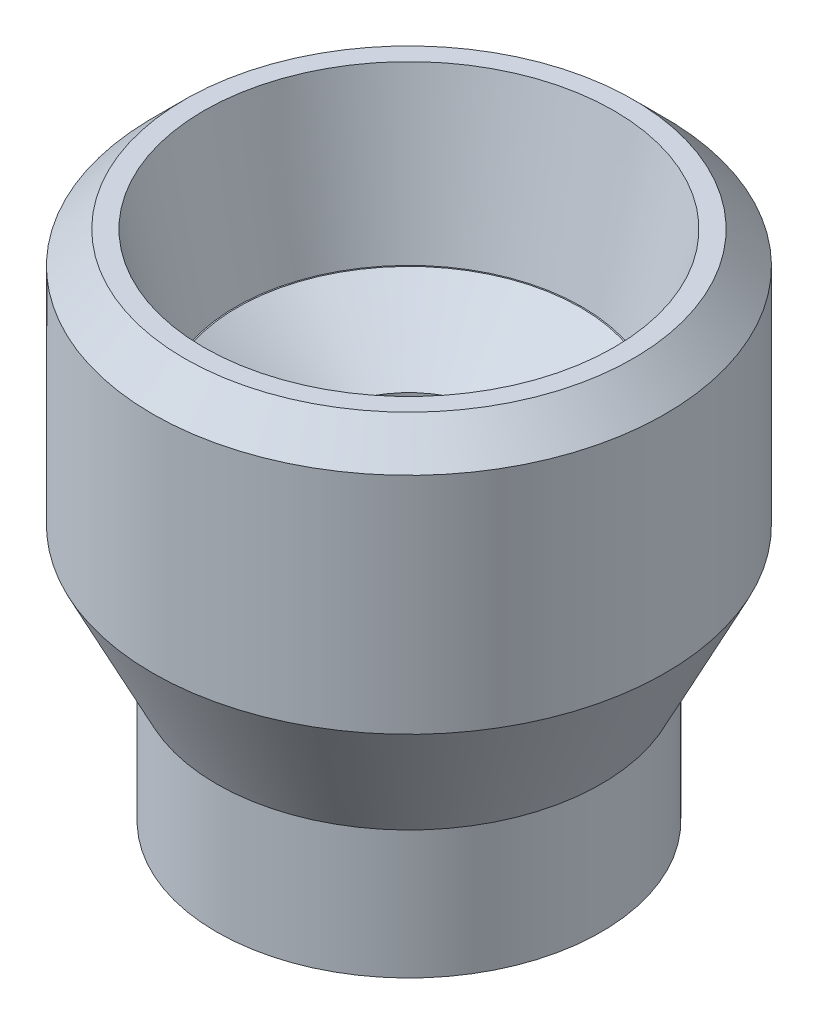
SolidWorks part; units mm, degrees
ref_plane "Přední rovina" through (0, 0, 0) normal (0, 0, 1) x (1, 0, 0)
ref_plane "Horní rovina" through (0, 0, 0) normal (0, 1, 0) x (1, 0, 0)
ref_plane "Pravá rovina" through (0, 0, 0) normal (1, 0, 0) x (0, 0, -1)
sketch "Skica1" plane through (0, 0, 0) normal (0, 1, 0) x (1, 0, 0)
  circle A0 centre (0, 0) radius 7.5
extrude "Přidat vysunutím1" add sketch "Skica1" along normal blind 10
sketch "Skica2" plane through (0, 10, 0) normal (0, 1, 0) x (1, 0, 0)
  circle A0 centre (0, 0) radius 10
extrude "Přidat vysunutím2" add sketch "Skica2" along normal blind 10
chamfer "Zkosení1" distance 5 distance2 2.5 1 edges at (0, 10, 7.5)
sketch "Skica3" plane through (0, 0, 0) normal (0, -1, 0) x (1, 0, 0)
  circle A0 centre (0, 0) radius 3.5
extrude "Odebrat vysunutím1" cut sketch "Skica3" against normal through all
sketch "Skica4" plane through (0, 20, 0) normal (0, 1, 0) x (1, 0, 0)
  circle A0 centre (0, 0) radius 8
extrude "Odebrat vysunutím2" cut sketch "Skica4" against normal blind 6
chamfer "Zkosení4" distance 6 distance2 1.25 1 edges at (0, 14, 8)
chamfer "Zkosení5" distance 2 angle 58 1 edges at (0, 14, 3.5)
chamfer "Zkosení6" distance 1.25 angle 45 1 edges at (0, 20, 10)
